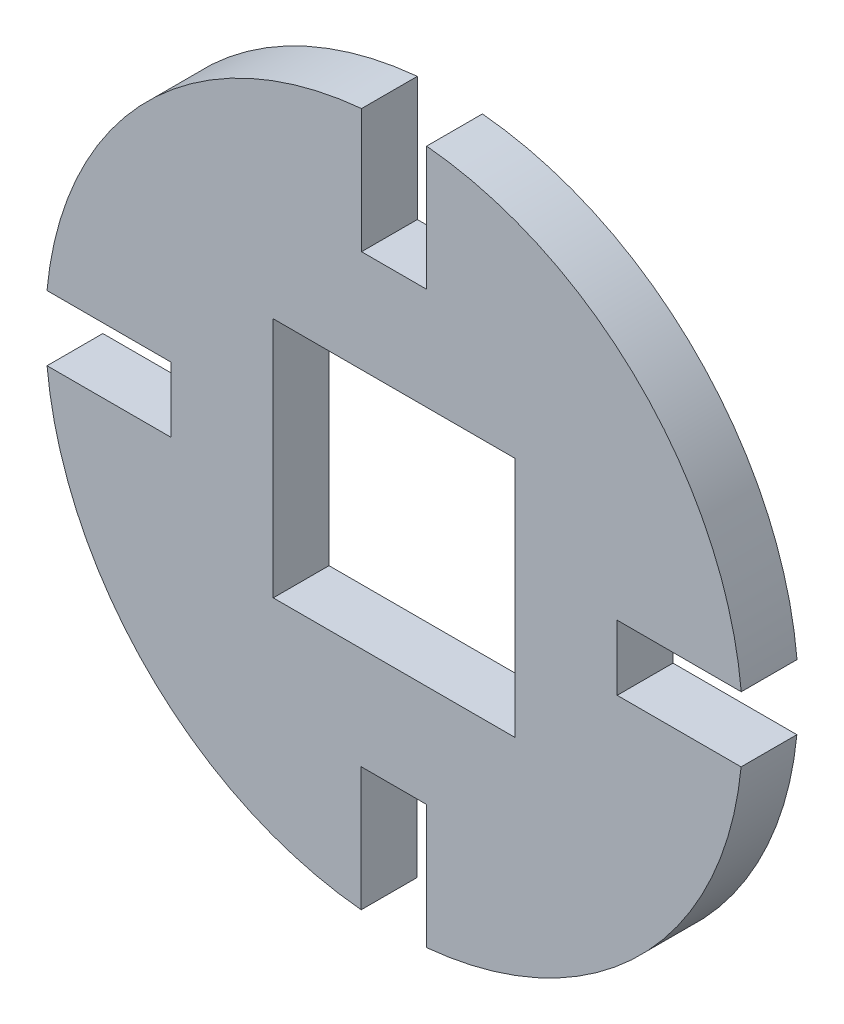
SolidWorks part; units mm, degrees
ref_plane "Alzado" through (0, 0, 0) normal (0, 0, 1) x (1, 0, 0)
ref_plane "Planta" through (0, 0, 0) normal (0, 1, 0) x (1, 0, 0)
ref_plane "Vista lateral" through (0, 0, 0) normal (1, 0, 0) x (0, 0, -1)
sketch "Sketch1" plane through (0, 0, 0) normal (0, 0, 1) x (1, 0, 0)
  line L0 (12, -1.7899) -> (12, 1.7101)
  line L1 (-6.5, -6.5) -> (6.5, -6.5)
  line L2 (-6.5, -6.5) -> (-6.5, 6.5)
  line L3 (-6.5, 6.5) -> (6.5, 6.5)
  line L4 (6.5, -6.5) -> (6.5, 6.5)
  line L5 (-6.5, -6.5) -> (6.5, 6.5) construction
  line L6 (-6.5, 6.5) -> (6.5, -6.5) construction
  line L7 (12, 1.7101) -> (18.6718, 1.7101)
  line L8 (12, -1.7899) -> (18.6644, -1.7899)
  line L9 (-12, -1.7698) -> (-12, 1.7302)
  line L10 (-12, 1.7302) -> (-18.67, 1.7302)
  line L11 (-12, -1.7698) -> (-18.6663, -1.7698)
  line L12 (-1.75, 11.9982) -> (1.75, 11.9982)
  line L13 (-1.75, 11.9982) -> (-1.75, 18.6682)
  line L14 (1.75, 11.9982) -> (1.75, 18.6682)
  line L15 (-1.7698, -12) -> (1.7302, -12)
  line L16 (-1.7698, -12) -> (-1.7698, -18.6663)
  line L17 (1.7302, -12) -> (1.7302, -18.67)
  arc A0 (18.6718, 1.7101) -> (1.75, 18.6682) centre (0, 0) ccw
  arc A1 (-18.6663, -1.7698) -> (-1.7698, -18.6663) centre (0, 0) ccw
  arc A2 (-1.75, 18.6682) -> (-18.67, 1.7302) centre (0, 0) ccw
  arc A3 (1.7302, -18.67) -> (18.6644, -1.7899) centre (0, 0) ccw
  point P10 (12, -0.0399)
  point P14 (-12, -0.0198)
  point P19 (0, 11.9982)
  point P24 (-0.0198, -12)
  dimension "D1" = 37.5
  dimension "D2" = 13
  dimension "D3" = 13
  dimension "D4" = 3.5
  dimension "D5" = 5.5
  dimension "D6" = 6.6718
  dimension "D7" = 3.5
  dimension "D8" = 5.5
  dimension "D9" = 6.67
  dimension "D10" = 3.5
  dimension "D11" = 6.67
  dimension "D12" = 5.4982
  dimension "D13" = 3.5
  dimension "D14" = 5.5
  dimension "D15" = 6.67
extrude "Boss-Extrude1" add sketch "Sketch1" along normal blind 3
